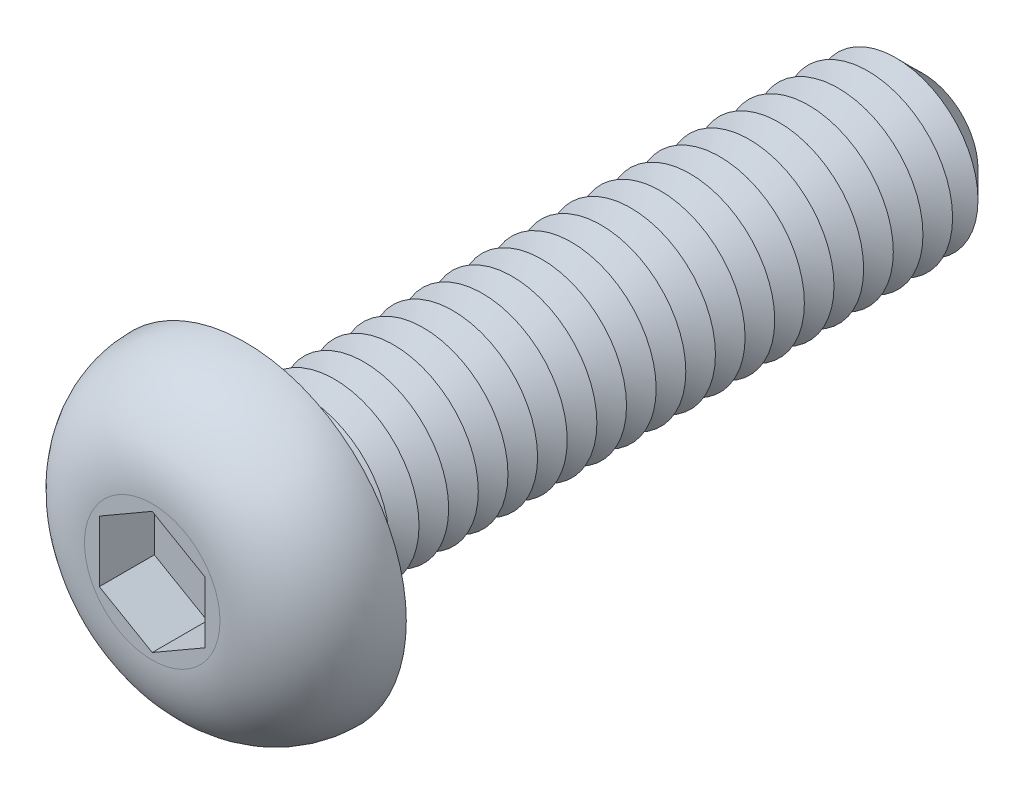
SolidWorks part; units mm, degrees
ref_plane "Front Plane" through (0, 0, 0) normal (0, 0, 1) x (1, 0, 0)
ref_plane "Top Plane" through (0, 0, 0) normal (0, 1, 0) x (1, 0, 0)
ref_plane "Right Plane" through (0, 0, 0) normal (1, 0, 0) x (0, 0, -1)
sketch "Sketch1" plane through (0, 0, 0) normal (1, 0, 0) x (0, 0, -1)
  line L0 (-47.9342, 0) -> (60.3146, 0) construction
sketch "Sketch2" plane through (0, 0, 0) normal (1, 0, 0) x (0, 0, -1)
  line L0 (0, 0) -> (-2.2, 0)
  line L1 (-47.9342, 0) -> (60.3146, 0) construction
  line L2 (-2.2, 0) -> (-2.2, 1.6)
  line L3 (0, 3.8) -> (0, 0)
  arc A0 (-2.2, 1.6) -> (0, 3.8) centre (0, 1.6) cw
  dimension "D1" = 2.2
  dimension "D2" = 2.2
  dimension "D3" = 3.8
revolve "Revolve1" add sketch "Sketch2" angle 360 about L0
sketch "Sketch3" plane through (0, 0, 2.2) normal (0, 0, 1) x (1, 0, 0)
  line L1 (0, 1.4434) -> (-1.25, 0.7217)
  line L2 (-1.25, 0.7217) -> (-1.25, -0.7217)
  line L3 (-1.25, -0.7217) -> (0, -1.4434)
  line L4 (0, -1.4434) -> (1.25, -0.7217)
  line L5 (1.25, -0.7217) -> (1.25, 0.7217)
  line L6 (1.25, 0.7217) -> (0, 1.4434)
  circle A0 centre (0, 0) radius 1.25 construction
  dimension "D1" = 2.5
extrude "Cut-Extrude1" cut sketch "Sketch3" against normal blind 1.3
sketch "Sketch4" plane through (0, 0, 0) normal (0, 0, -1) x (-1, 0, 0)
  circle A0 centre (0, 0) radius 2
  dimension "D1" = 4
extrude "Boss-Extrude1" add sketch "Sketch4" along normal blind 16
chamfer "Chamfer1" distance 0.7 angle 45 1 edges at (-2, 0, -16)
sketch "Sketch5" plane through (0, 0, 0) normal (1, 0, 0) x (0, 0, -1)
  line L0 (0.7, 2) -> (1.4, 2)
  line L1 (15.3, 2) -> (0, 2) construction
  line L2 (1.4, 2) -> (1.05, 1.3938)
  line L3 (1.05, 1.3938) -> (0.7, 2)
  line L4 (0, -3.8) -> (0, 3.8) construction
  line L5 (15.3, 2) -> (0, 2) construction
  dimension "D1" = 0.7
  dimension "D2" = 0.7
revolve "Cut-Revolve1" cut sketch "Sketch5" angle 360 about L0
pattern_linear "LPattern1" count 21 spacing 0.7 along (0, 0, -1) of "Cut-Revolve1"
fillet "Fillet2" radius 0.35 1 edges at (2, 0, 0)
sketch "Sketch6" plane through (0, 0, 0.9) normal (0, 0, 1) x (1, 0, 0)
  circle A0 centre (0, 0) radius 0.5
  dimension "D1" = 1
extrude "Cut-Extrude2" cut sketch "Sketch6" against normal up to surface (16.9 mm away)
